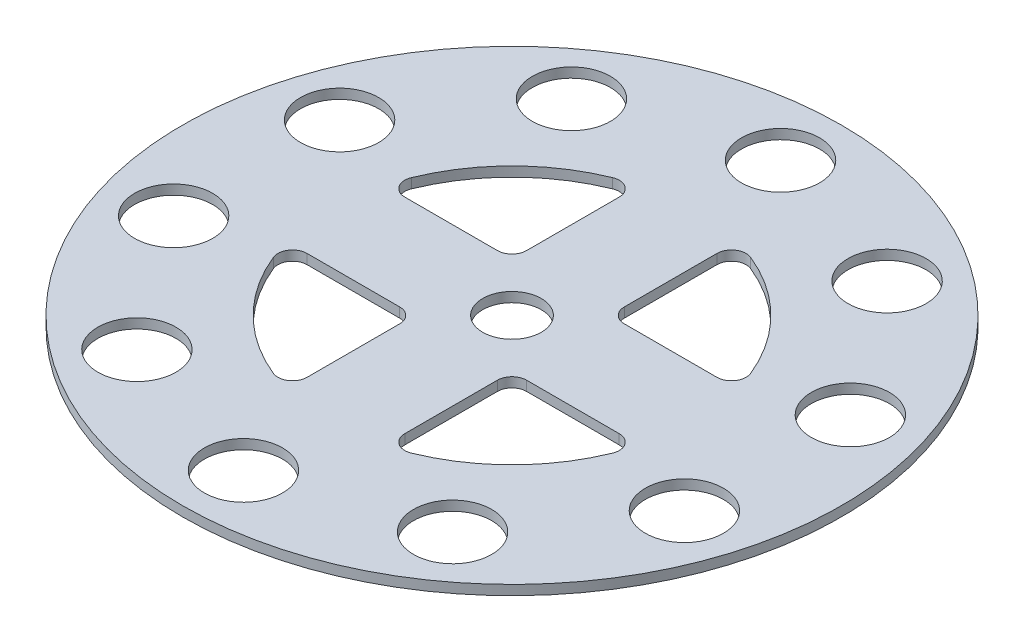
SolidWorks part; units mm, degrees
ref_plane "Front" through (0, 0, 0) normal (0, 0, 1) x (1, 0, 0)
ref_plane "Top" through (0, 0, 0) normal (0, 1, 0) x (1, 0, 0)
ref_plane "Right" through (0, 0, 0) normal (1, 0, 0) x (0, 0, -1)
sketch "Sketch1" plane through (0, 0, 0) normal (0, 1, 0) x (1, 0, 0)
  line L0 (-10, 36.1421) -> (-10, 10)
  line L1 (-36.1421, 10) -> (-10, 10)
  line L2 (10, 36.1421) -> (10, 10)
  line L3 (36.1421, -10) -> (10, -10)
  line L4 (-10, -10) -> (-10, -36.1421)
  line L5 (10, 10) -> (36.1421, 10)
  line L6 (10, -10) -> (10, -36.1421)
  line L7 (-10, -10) -> (-36.1421, -10)
  line L8 (-10, -10) -> (10, -10) construction
  line L9 (10, 10) -> (10, -10) construction
  arc A0 (-36.1421, -10) -> (-10, -36.1421) centre (0, 0) ccw
  circle A1 centre (0, 0) radius 67.5
  arc A3 (-10, 36.1421) -> (-36.1421, 10) centre (0, 0) ccw
  arc A4 (36.1421, 10) -> (10, 36.1421) centre (0, 0) ccw
  arc A5 (10, -36.1421) -> (36.1421, -10) centre (0, 0) ccw
  point P6 (0, -10)
  point P9 (10, 0)
  dimension "D2" = 135
  dimension "D3" = 75
  dimension "D4" = 20
extrude "Boss-Extrude1" add sketch "Sketch1" along normal blind 2
sketch "Sketch2" plane through (0, 2, 0) normal (0, 1, 0) x (1, 0, 0)
  circle A0 centre (0, 55) radius 8
  circle A1 centre (0, 0) radius 55 construction
  dimension "D1" = 16
  dimension "D2" = 110
extrude "Cut-Extrude1" cut sketch "Sketch2" against normal through all
pattern_circular "CirPattern1" count 10 over 360 about axis through (0, 0, 0) along (0, 1, 0) of "Cut-Extrude1"
sketch "Sketch3" plane through (0, 2, 0) normal (0, 1, 0) x (1, 0, 0)
  circle A0 centre (0, 0) radius 6
  dimension "D1" = 12
extrude "Cut-Extrude2" cut sketch "Sketch3" against normal through all
fillet "Fillet1" radius 3 12 edges at (36.1421, 1, 10) (10, 1, 36.1421) (10, 1, 10) (-10, 1, 10) (-10, 1, 36.1421) (-36.1421, 1, 10) (36.1421, 1, -10) (10, 1, -36.1421) (10, 1, -10) (-10, 1, -36.1421) (-10, 1, -10) (-36.1421, 1, -10)
